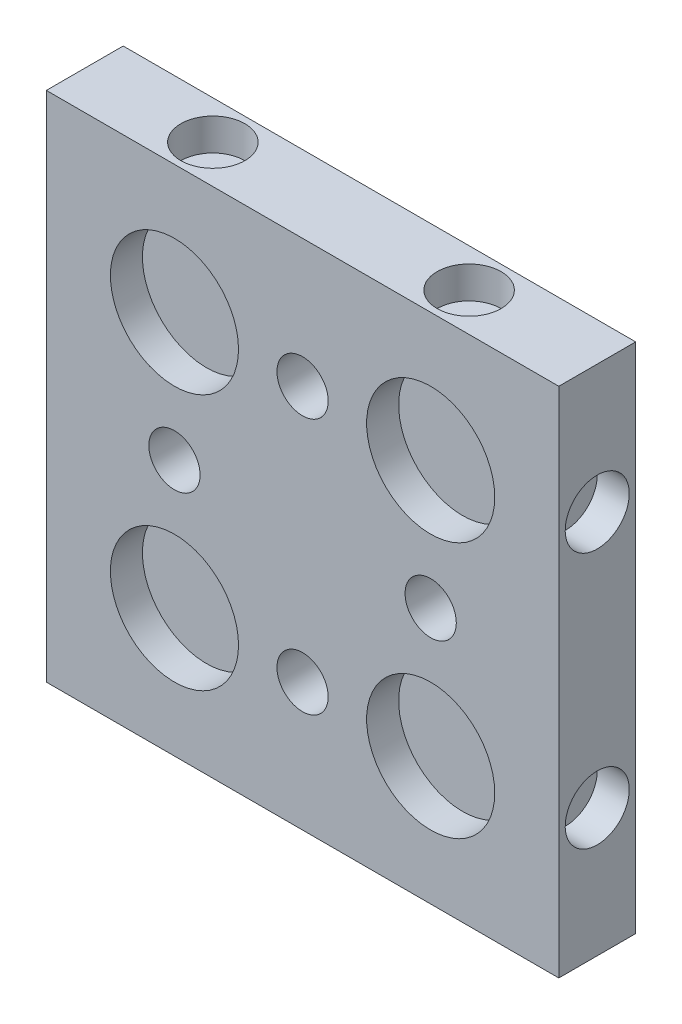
SolidWorks part; units mm, degrees
ref_plane "Front Plane" through (0, 0, 0) normal (0, 0, 1) x (1, 0, 0)
ref_plane "Top Plane" through (0, 0, 0) normal (0, 1, 0) x (1, 0, 0)
ref_plane "Right Plane" through (0, 0, 0) normal (1, 0, 0) x (0, 0, -1)
sketch "Sketch1" plane through (0, 0, 0) normal (0, 0, 1) x (1, 0, 0)
  line L1 (-21.3507, 25.9522) -> (29.4493, 25.9522)
  line L2 (-21.3507, 25.9522) -> (-21.3507, -24.8478)
  line L3 (-21.3507, -24.8478) -> (29.4493, -24.8478)
  line L4 (29.4493, 25.9522) -> (29.4493, -24.8478)
  dimension "D1" = 50.8
  dimension "D2" = 50.8
extrude "Boss-Extrude1" add sketch "Sketch1" along normal blind 7.62
sketch "Sketch2" plane through (0, 0, 7.62) normal (0, 0, 1) x (1, 0, 0)
  line L0 (4.0493, 25.9522) -> (4.0493, -24.8478)
  line L1 (29.4493, 25.9522) -> (-21.3507, 25.9522) construction
  line L2 (-21.3507, -24.8478) -> (29.4493, -24.8478) construction
  line L3 (29.4493, 0.5522) -> (-21.3507, 0.5522)
  line L4 (29.4493, -24.8478) -> (29.4493, 25.9522) construction
  line L5 (-21.3507, 25.9522) -> (-21.3507, -24.8478) construction
  line L6 (-8.6507, 25.9522) -> (-8.6507, -24.8478)
  line L7 (16.7493, 25.9522) -> (16.7493, -24.8478)
  line L8 (-21.3507, 13.2522) -> (29.4493, 13.2522)
  line L9 (29.4493, -12.1478) -> (-21.3507, -12.1478)
  dimension "D1" = 12.7
  dimension "D2" = 12.7
  dimension "D3" = 12.7
  dimension "D4" = 12.7
sketch "Sketch3" plane through (0, 0, 7.62) normal (0, 0, 1) x (1, 0, 0)
  line L0 (-8.6507, 25.9522) -> (-8.6507, -24.8478) construction
  line L1 (-21.3507, 13.2522) -> (29.4493, 13.2522) construction
  line L2 (29.4493, -12.1478) -> (-21.3507, -12.1478) construction
  line L3 (16.7493, 25.9522) -> (16.7493, -24.8478) construction
  circle A0 centre (-8.6507, 0.5522) radius 2.54
  circle A1 centre (4.0493, 13.2522) radius 2.54
  circle A2 centre (4.0493, -12.1478) radius 2.54
  circle A3 centre (16.7493, 0.5522) radius 2.54
extrude "Cut-Extrude1" cut sketch "Sketch3" against normal through all
sketch "Sketch4" plane through (0, 0, 7.62) normal (0, 0, 1) x (1, 0, 0)
  line L0 (-8.6507, 25.9522) -> (-8.6507, -24.8478) construction
  line L1 (-21.3507, 13.2522) -> (29.4493, 13.2522) construction
  line L3 (29.4493, -24.8478) -> (29.4493, 25.9522) construction
  line L4 (29.4493, 25.9522) -> (-21.3507, 25.9522) construction
  line L5 (-21.3507, -24.8478) -> (29.4493, -24.8478) construction
  circle A0 centre (-8.6507, 13.2522) radius 6.35
  circle A2 centre (16.7493, 13.2522) radius 6.35
  circle A3 centre (16.7493, -12.1478) radius 6.35
  circle A4 centre (-8.6507, -12.1478) radius 6.35
  dimension "D1" = 12.7
  dimension "D5" = 12.7
  dimension "D3" = 12.7
  dimension "D4" = 12.7
extrude "Cut-Extrude2" cut sketch "Sketch4" against normal blind 3.175
sketch "Sketch5" plane through (29.4493, 0, 0) normal (1, 0, 0) x (0, 0, -1)
  line L0 (-7.62, 25.9522) -> (0, 25.9522) construction
  line L1 (-7.62, -24.8478) -> (-7.62, 25.9522) construction
  line L2 (-7.62, -24.8478) -> (0, -24.8478) construction
  circle A0 centre (-3.81, 13.2522) radius 3.175
  circle A1 centre (-3.81, -12.1478) radius 3.175
  dimension "D1" = 3.81
  dimension "D2" = 12.7
  dimension "D3" = 3.81
  dimension "D4" = 12.7
extrude "Cut-Extrude3" cut sketch "Sketch5" against normal blind 3.175
sketch "Sketch6" plane through (0, -24.8478, 0) normal (0, -1, 0) x (-1, 0, 0)
  line L0 (21.3507, -7.62) -> (21.3507, 0) construction
  line L1 (21.3507, -7.62) -> (-29.4493, -7.62) construction
  line L2 (-29.4493, -7.62) -> (-29.4493, 0) construction
  circle A0 centre (8.6507, -3.81) radius 3.175
  circle A1 centre (-16.7493, -3.81) radius 3.175
  dimension "D1" = 12.7
  dimension "D3" = 3.81
  dimension "D2" = 3.81
  dimension "D4" = 12.7
extrude "Cut-Extrude4" cut sketch "Sketch6" against normal blind 3.175
sketch "Sketch7" plane through (-21.3507, 0, 0) normal (-1, 0, 0) x (0, 0, 1)
  line L0 (7.62, 25.9522) -> (0, 25.9522) construction
  line L1 (7.62, 25.9522) -> (7.62, -24.8478) construction
  line L2 (7.62, -24.8478) -> (0, -24.8478) construction
  line L3 (7.62, 25.9522) -> (7.62, -24.8478) construction
  circle A0 centre (3.81, 13.2522) radius 3.175
  circle A1 centre (3.81, -12.1478) radius 3.175
  dimension "D1" = 12.7
  dimension "D3" = 12.7
  dimension "D2" = 3.81
  dimension "D4" = 3.81
extrude "Cut-Extrude5" cut sketch "Sketch7" against normal blind 3.175
sketch "Sketch8" plane through (0, 25.9522, 0) normal (0, 1, 0) x (1, 0, 0)
  line L0 (-21.3507, -7.62) -> (-21.3507, 0) construction
  line L1 (29.4493, -7.62) -> (-21.3507, -7.62) construction
  line L2 (29.4493, -7.62) -> (29.4493, 0) construction
  line L3 (29.4493, -7.62) -> (-21.3507, -7.62) construction
  circle A0 centre (-8.6507, -3.81) radius 3.175
  circle A1 centre (16.7493, -3.81) radius 3.175
  dimension "D3" = 12.7
  dimension "D4" = 3.81
  dimension "D1" = 12.7
  dimension "D2" = 3.81
extrude "Cut-Extrude6" cut sketch "Sketch8" against normal blind 3.175
